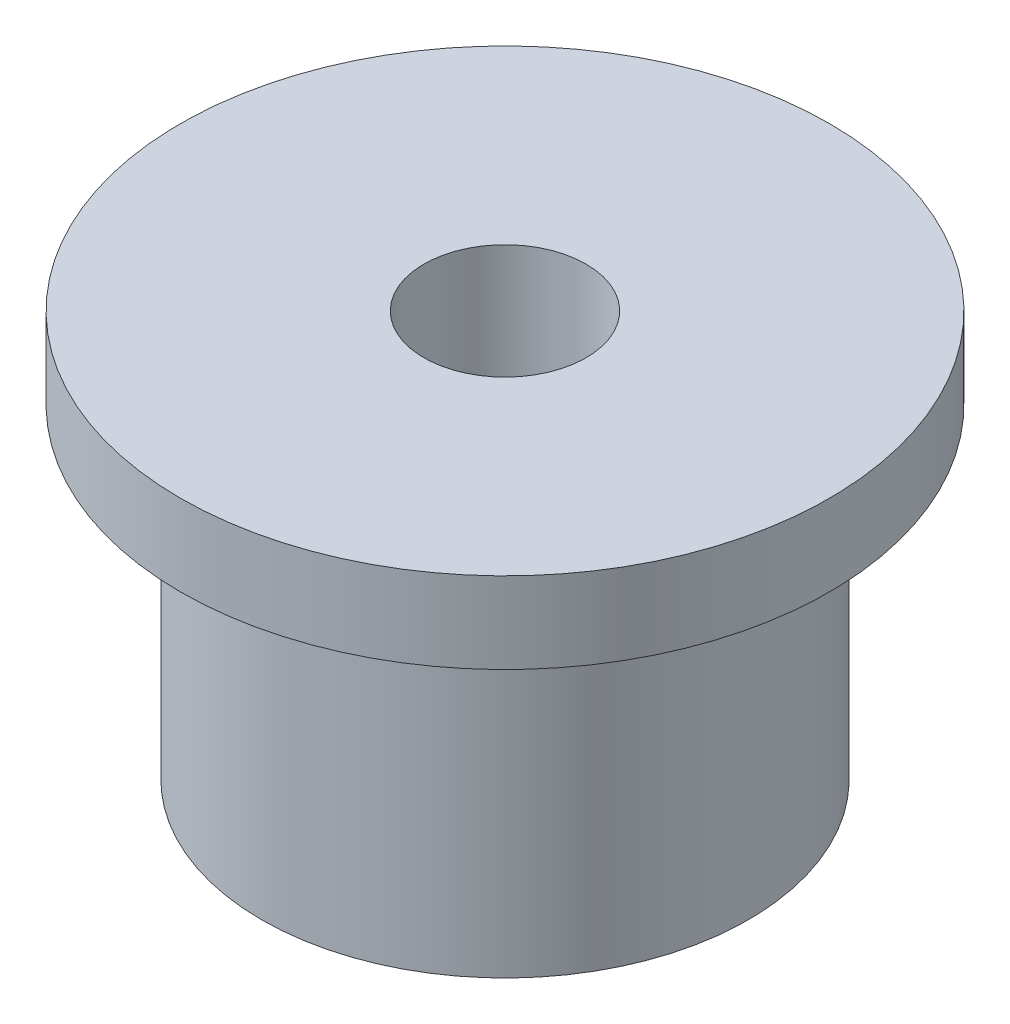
SolidWorks part; units mm, degrees
ref_plane "Front Plane" through (0, 0, 0) normal (0, 0, 1) x (1, 0, 0)
ref_plane "Top Plane" through (0, 0, 0) normal (0, 1, 0) x (1, 0, 0)
ref_plane "Right Plane" through (0, 0, 0) normal (1, 0, 0) x (0, 0, -1)
sketch "Sketch1" plane through (0, 0, 0) normal (0, 0, 1) x (1, 0, 0)
  line L0 (0, 0) -> (0, 6543.5998) construction
  line L1 (25, 0) -> (25, 125)
  line L2 (25, 125) -> (100, 125)
  line L3 (100, 125) -> (100, 100)
  line L4 (100, 100) -> (75, 100)
  line L5 (75, 100) -> (75, 0)
  line L6 (75, 0) -> (25, 0)
  dimension "D1" = 25
  dimension "D2" = 75
  dimension "D3" = 100
  dimension "D4" = 25
  dimension "D5" = 125
  dimension "D6" = 0
  dimension "D7" = 0
revolve "Revolve1" add sketch "Sketch1" angle 360 about L0
